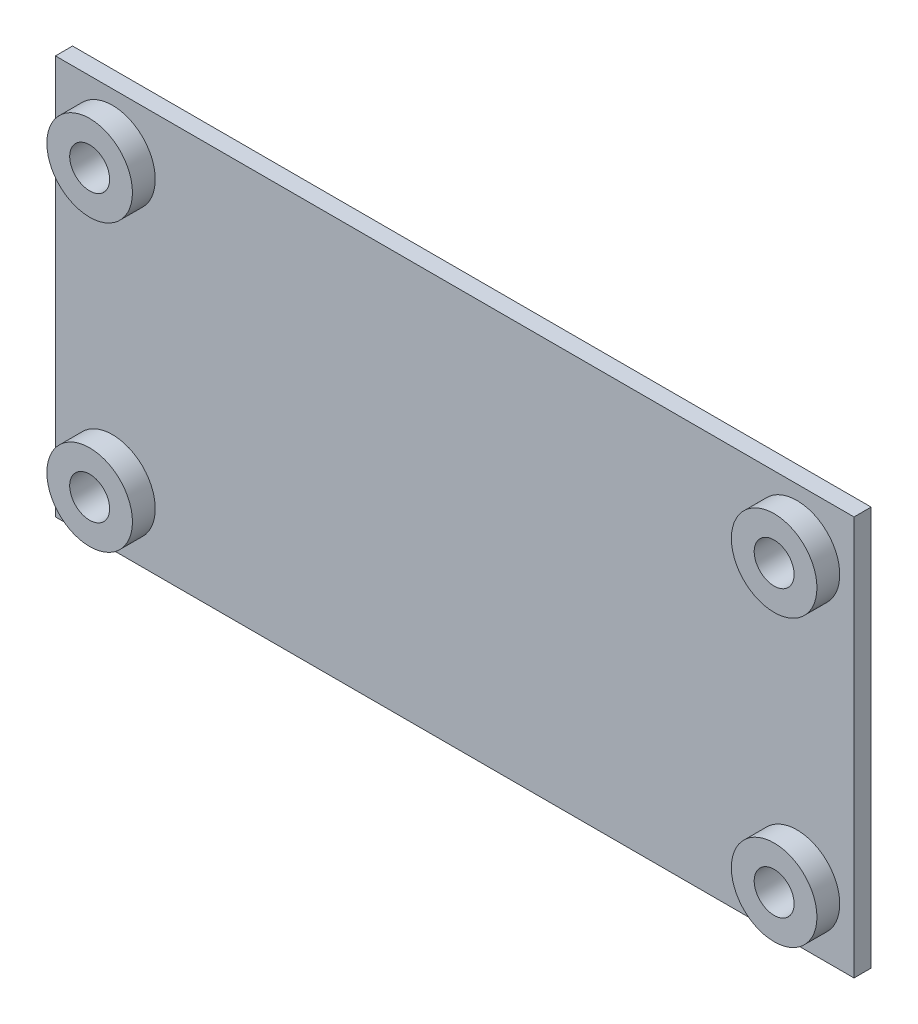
SolidWorks part; units mm, degrees
ref_plane "Plan de face" through (0, 0, 0) normal (0, 0, 1) x (1, 0, 0)
ref_plane "Plan de dessus" through (0, 0, 0) normal (0, 1, 0) x (1, 0, 0)
ref_plane "Plan de droite" through (0, 0, 0) normal (1, 0, 0) x (0, 0, -1)
sketch "Esquisse1" plane through (0, 0, 0) normal (0, 0, 1) x (1, 0, 0)
  line L1 (0, 0) -> (70, 0)
  line L2 (0, 0) -> (0, 35)
  line L3 (0, 35) -> (70, 35)
  line L4 (70, 0) -> (70, 35)
  line L5 (5, 5) -> (65, 5) construction
  line L6 (5, 5) -> (5, 30) construction
  line L7 (5, 30) -> (65, 30) construction
  line L8 (65, 5) -> (65, 30) construction
  circle A0 centre (5, 5) radius 1.75
  circle A1 centre (5, 30) radius 1.75
  circle A2 centre (65, 30) radius 1.75
  circle A3 centre (65, 5) radius 1.75
  dimension "D3" = 3.5
  dimension "D1" = 70
  dimension "D2" = 35
  dimension "D4" = 5
  dimension "D5" = 5
  dimension "D6" = 5
  dimension "D7" = 5
extrude "Boss.-Extru.1" add sketch "Esquisse1" along normal blind 1.5
sketch "Esquisse2" plane through (0, 0, 1.5) normal (0, 0, 1) x (1, 0, 0)
  circle A0 centre (5, 30) radius 1.75 construction
  circle A1 centre (5, 5) radius 1.75 construction
  circle A2 centre (65, 5) radius 1.75 construction
  circle A3 centre (65, 30) radius 1.75 construction
  circle A4 centre (5, 30) radius 1.75
  circle A5 centre (5, 5) radius 1.75
  circle A6 centre (65, 5) radius 1.75
  circle A7 centre (65, 30) radius 1.75
extrude "Extru.-Mince1" add sketch "Esquisse2" along normal blind 2 separate body thin
